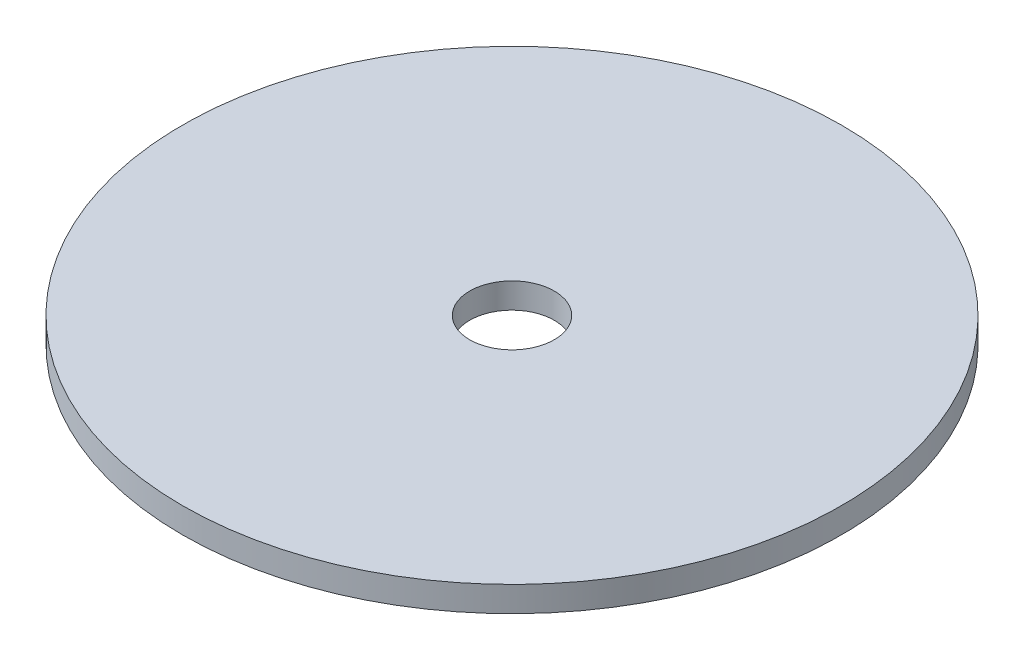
SolidWorks part; units mm, degrees
ref_plane "Plan de face" through (0, 0, 0) normal (0, 0, 1) x (1, 0, 0)
ref_plane "Plan de dessus" through (0, 0, 0) normal (0, 1, 0) x (1, 0, 0)
ref_plane "Plan de coté" through (0, 0, 0) normal (1, 0, 0) x (0, 0, -1)
sketch "Esquisse1" plane through (0, 0, 0) normal (0, 1, 0) x (1, 0, 0)
  circle A0 centre (0, 0) radius 39
  circle A1 centre (0, 0) radius 5
  dimension "D1" = 78
  dimension "D2" = 10
extrude "Boss.-Extru.1" add sketch "Esquisse1" along normal mid plane 3
